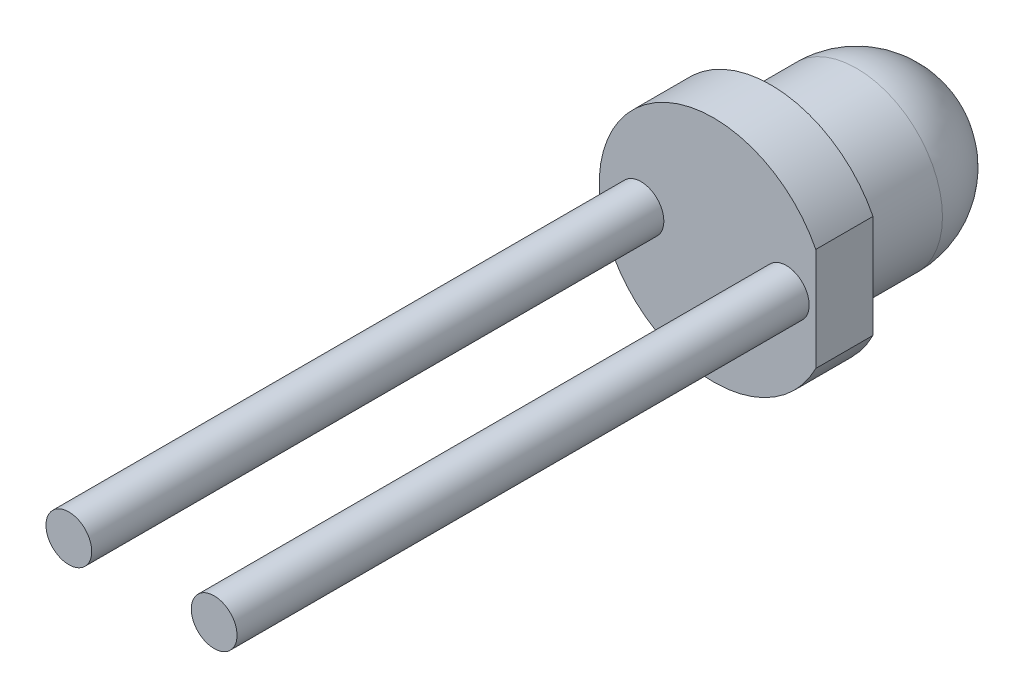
SolidWorks part; units mm, degrees
ref_plane "Face" through (0, 0, 0) normal (0, 0, 1) x (1, 0, 0)
ref_plane "Dessus" through (0, 0, 0) normal (0, 1, 0) x (1, 0, 0)
ref_plane "Droite" through (0, 0, 0) normal (1, 0, 0) x (0, 0, -1)
sketch "Esquisse1" plane through (0, 0, 0) normal (0, 0, 1) x (1, 0, 0)
  circle A0 centre (0, 0) radius 1.5
  dimension "D1" = 3
extrude "Base-Extrusion" add sketch "Esquisse1" along normal blind 4
sketch "Esquisse2" plane through (0, 0, 4) normal (0, 0, 1) x (1, 0, 0)
  line L0 (1.7857, -2.4917) -> (1.7857, 2.5621) construction
  line L1 (1.7857, 0.9007) -> (1.7857, -0.9007)
  arc A0 (1.7857, 0.9007) -> (1.7857, -0.9007) centre (0, 0) ccw
  dimension "D1" = 2
extrude "Boss.-Extru.1" add sketch "Esquisse2" against normal blind 1
fillet "Congé1" radius 1.5 1 edges at (1.5, 0, 0)
sketch "Esquisse3" plane through (0, 0, 4) normal (0, 0, 1) x (1, 0, 0)
  line L0 (0, 1.1477) -> (0, -1.0016) construction
  circle A0 centre (1.27, 0) radius 0.4
  circle A1 centre (-1.27, 0) radius 0.4
extrude "Extrusion1" add sketch "Esquisse3" along normal blind 10
